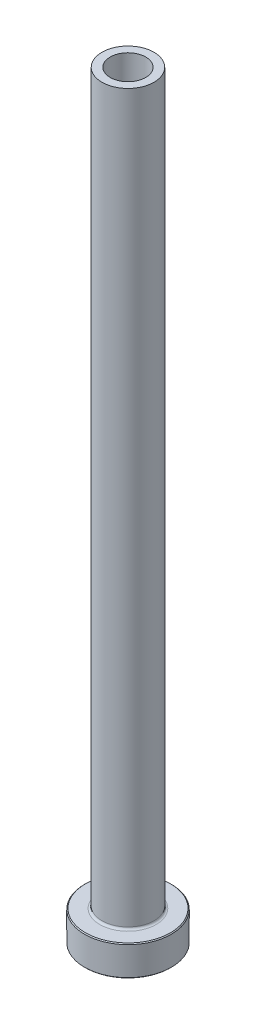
SolidWorks part; units mm, degrees
ref_plane "Front Plane" through (0, 0, 0) normal (0, 0, 1) x (1, 0, 0)
ref_plane "Top Plane" through (0, 0, 0) normal (0, 1, 0) x (1, 0, 0)
ref_plane "Right Plane" through (0, 0, 0) normal (1, 0, 0) x (0, 0, -1)
sketch "Sketch1" plane through (0, 0, 0) normal (0, 0, 1) x (1, 0, 0)
  line L0 (-4.1, 175) -> (-6, 175)
  line L1 (-6, 175) -> (-6, 7)
  line L2 (-6, 7) -> (-10, 7)
  line L3 (-10, 7) -> (-10, 0)
  line L4 (11, 0) -> (-11, 0) construction
  line L5 (-10, 0) -> (-4.35, 0)
  line L6 (-4.1, 130) -> (-4.1, 175)
  line L7 (0, 92.1877) -> (0, -15.5353) construction
  line L8 (0, -11) -> (0, 11) construction
  line L9 (-4.1, 130) -> (-4.35, 118)
  line L10 (-4.35, 118) -> (-4.35, 0)
  dimension "D1" = 0.25
  dimension "ID" = 8.2
  dimension "OD" = 12
  dimension "L" = 175
  dimension "H" = 20
  dimension "T" = 7
  dimension "N" = 45
  dimension "D2" = 12
revolve "Revolve1" add sketch "Sketch1" angle 360 about L7
fillet "Fillet1" radius 0.5 1 edges at (0, 7, 6)
chamfer "Chamfer1" distance 0.2 angle 45 2 edges at (0, 7, 10) (0, 0, 10)
chamfer "Chamfer3" distance 0.5 angle 45 1 edges at (0, 0, 4.35)
